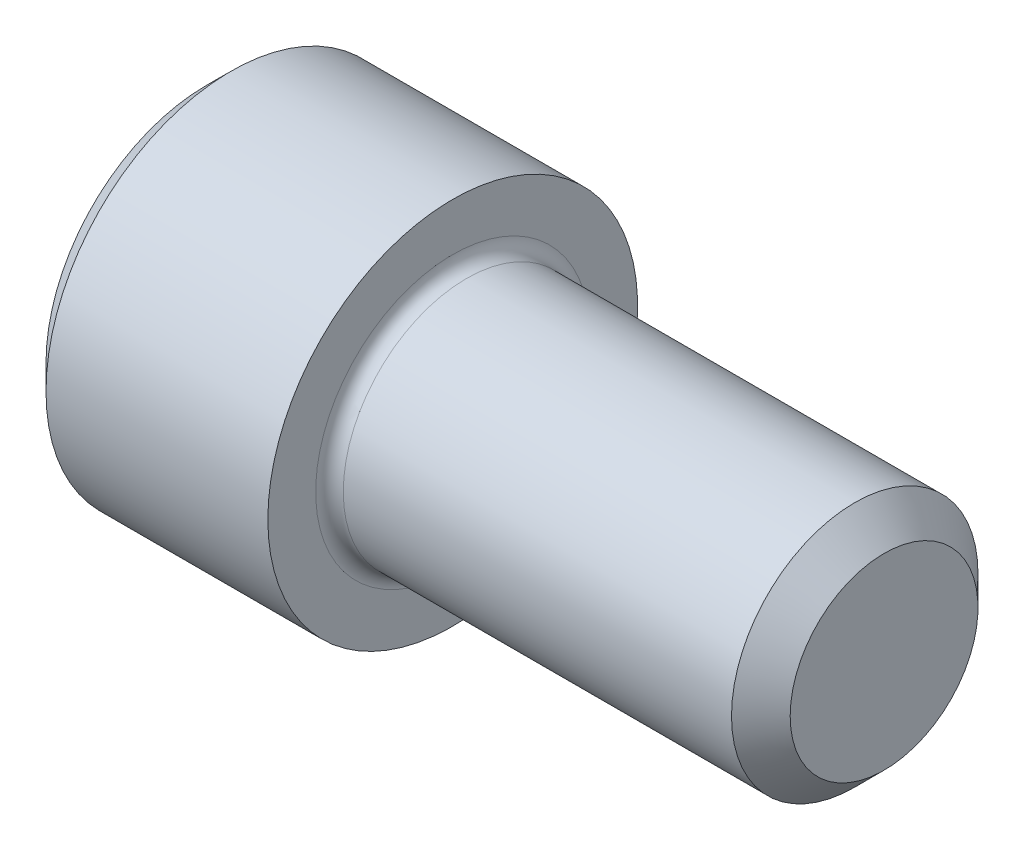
SolidWorks part; units mm, degrees
ref_plane "Plane1" through (0, 0, 0) normal (0, 0, 1) x (1, 0, 0)
ref_plane "Plane2" through (0, 0, 0) normal (0, 1, 0) x (1, 0, 0)
ref_plane "Plane3" through (0, 0, 0) normal (1, 0, 0) x (0, 0, -1)
revolve "Base-Revolve" add sketch "BodySke"
sketch "BodySke" plane through (0, 0, 0) normal (0, 0, 1) x (1, 0, 0)
  line L0 (0, 0) -> (0, 4.1275)
  line L1 (0.635, 4.7625) -> (6.35, 4.7625)
  line L2 (6.35, 4.7625) -> (6.35, 3.175)
  line L3 (6.35, 3.175) -> (16.7068, 3.175)
  line L4 (17.4625, 2.4193) -> (17.4625, 0)
  line L5 (17.4625, 0) -> (0, 0)
  line L6 (-31.75, 0) -> (127, 0) construction
  line L7 (0, 4.1275) -> (0.635, 4.7625)
  line L8 (17.4625, 2.4193) -> (16.7068, 3.175)
  line L9 (0, -4.1275) -> (0.635, -4.7625) construction
  line L10 (17.4625, -2.4194) -> (16.7069, -3.175) construction
  line L11 (7.62, 9.525) -> (7.62, 3.175) construction
  line L12 (6.35, 9.525) -> (6.35, 3.175) construction
  line L13 (-20.6375, 9.525) -> (-20.6375, 3.175) construction
  dimension "Diameter" = 6.35
  dimension "Head_ht" = 6.35
  dimension "Length" = 11.1125
  dimension "Body_ch_ang" = 45
  dimension "Head_dia" = 9.525
  dimension "Head_ch_ang" = 45
  dimension "Head_side_ht" = 5.715
  dimension "Minor_dia" = 4.8387
  dimension "Advance" = 1.27
  dimension "Thread_nom" = 11.1125
  dimension "Thread_length" = 38.1
fillet "Fillet1" radius 0.3556 1 edges at (6.35, 0, 3.175)
sketch "Sketch2" plane through (0, 0, 0) normal (0, 0, 1) x (1, 0, 0)
  line L0 (0, 2.3812) -> (3.048, 2.3812)
  line L1 (3.048, 2.3812) -> (4.4228, 0)
  line L2 (-31.75, 0) -> (127, 0) construction
  line L3 (4.4228, 0) -> (0, 0)
  line L4 (0, 0) -> (0, 2.3812)
  line L5 (0, 4.1275) -> (0, -4.1275) construction
  line L6 (0, 0) -> (47.625, 0) construction
  line L7 (6.35, -4.7625) -> (6.35, 4.7625) construction
  dimension "D1" = 2.3813
  dimension "D2" = 60
  dimension "Wall_thickness" = 3.302
revolve "Hex-PreBroach" cut sketch "Sketch2" angle 360 about L6
sketch "Sketch3" plane through (0, 0, 0) normal (-1, 0, 0) x (0, 0.5, 0.866)
  line L0 (1.3748, 2.3813) -> (-1.3748, 2.3813)
  line L1 (-1.3748, 2.3813) -> (-2.7496, 0)
  line L2 (1.3748, 2.3813) -> (2.7496, 0)
  line L3 (1.3748, -2.3812) -> (2.7496, 0)
  line L4 (1.3748, -2.3812) -> (-1.3748, -2.3812)
  line L5 (-1.3748, -2.3812) -> (-2.7496, 0)
  dimension "D1" = 2.3813
  dimension "D2" = 2.3813
  dimension "Hex_size" = 4.7625
extrude "Hex" cut sketch "Sketch3" against normal blind 3.048
sketch "Sketch4" plane through (0, 0, 0) normal (-1, 0, 0) x (0, 0, 1)
  line L0 (0, 0) -> (2.8067, 0)
  line L1 (0, 0) -> (6.1484, 3.5498) construction
  line L2 (0, 0) -> (1.4033, 2.4307)
  line L3 (2.3336, 0.614) -> (2.6851, 0.817)
  line L4 (1.6986, 1.7139) -> (2.0501, 1.9169)
  arc A0 (2.3336, 0.614) -> (1.6986, 1.7139) centre (0, 0) ccw
  arc A1 (2.8067, 0) -> (2.6851, 0.817) centre (0, 0) ccw
  arc A2 (1.4033, 2.4307) -> (2.0501, 1.9169) centre (0, 0) cw
  dimension "D1" = 30
  dimension "Spline_n_dim" = 4.826
  dimension "Spline_m_dim" = 5.6134
  dimension "D2" = 60
  dimension "D3" = 0.635
  dimension "Spline_p_dim" = 1.27
extrude "Spline" cut sketch "Sketch4" against normal blind 3.048
pattern_circular "CirPattern1" count 6 every 60
sketch "Sketch5" plane through (0, 0, 0) normal (0, 0, 1) x (1, 0, 0)
  line L0 (-31.75, 0) -> (127, 0) construction
  line L2 (0, 4.1275) -> (0, -4.1275) construction
  circle A0 centre (2.159, 0) radius 0.5905
  dimension "Drilled_hole_dia" = 1.1811
  dimension "Drilled_hole_loc" = 2.159
extrude "Hole" cut sketch "Sketch5" against normal through all and the other way through all
pattern_circular "Drilled-4" count 2 every 60
pattern_circular "Drilled-6" count 3 every 60
sketch "ThdSchSke" plane through (0, 0, 0) normal (0, 0, 1) x (1, 0, 0)
  line L0 (7.62, -2.4194) -> (7.0909, -3.175)
  line L1 (7.62, -2.4194) -> (8.1491, -3.175)
  line L2 (8.1491, -3.175) -> (8.1491, -3.9688)
  line L3 (-3.175, 0) -> (5.1513, 0) construction
  line L5 (8.1491, -3.9688) -> (7.0909, -3.9688)
  line L6 (7.0909, -3.9688) -> (7.0909, -3.175)
  line L7 (0, 4.1275) -> (0, -4.1275) construction
  dimension "Thread_minor" = 4.8387
  dimension "Diameter" = 6.35
  dimension "Start" = 7.62
  dimension "SideAngle" = 55
  dimension "VeeAngle" = 70
  dimension "Overcut" = 7.9375
revolve "ThreadSchematic" cut sketch "ThdSchSke" angle 360 about L3
pattern_linear "ThdSchPat"
equation "\"D2@Sketch3\" = \"Hex_size@Sketch3\" / 2"
equation "\"D1@Sketch3\" = \"Hex_size@Sketch3\" / 2"
equation "\"D1@Sketch2\" = \"Hex_size@Sketch3\" / 2"
equation "\"D3@Sketch4\" = \"Spline_p_dim@Sketch4\" / 2"
equation "\"Thread_minor@ThreadCosmetic\"  =  \"Minor_dia@BodySke\""
equation "\"D2@CirPattern1\" = 360 / \"Num_teeth@CirPattern1\""
equation "\"Wall_thickness@Sketch2\" = \"Head_ht@BodySke\" - \"Key_eng@Hex\""
equation "\"Thread_length@ThreadCosmetic\" = ((sgn( (\"Length@BodySke\" - \"Advance@BodySke\" ) - \"Thread_nom@BodySke\" )-1)*( (\"Length@BodySke\" - \"Advance@BodySke\" ) - \"Thread_nom@BodySke\" ))/-2+ \"Thread_nom@BodySke\""
equation "\"Thread_minor@ThdSchSke\" = \"Minor_dia@BodySke\""
equation "\"Diameter@ThdSchSke\" = \"Diameter@BodySke\""
equation "\"Overcut@ThdSchSke\" = \"Diameter@BodySke\" * 1.25"
equation "\"Start@ThdSchSke\" = \"Head_ht@BodySke\" + \"Length@BodySke\" - \"Thread_length@ThreadCosmetic\"  '---Non-countersunk---"
equation "\"Num_threads@ThdSchPat\" = int( \"Thread_length@ThreadCosmetic\" / \"Advance@BodySke\" + 0.999 )  + 1"
equation "\"Advance@ThdSchPat\" = \"Thread_length@ThreadCosmetic\" /  (\"Num_threads@ThdSchPat\" - 1) 'relax it"
equation "\"Num_threads@ThdSchPat\" = \"Num_threads@ThdSchPat\" - sgn( \"Num_threads@ThdSchPat\" - 1) '---chamfered tips only---"
